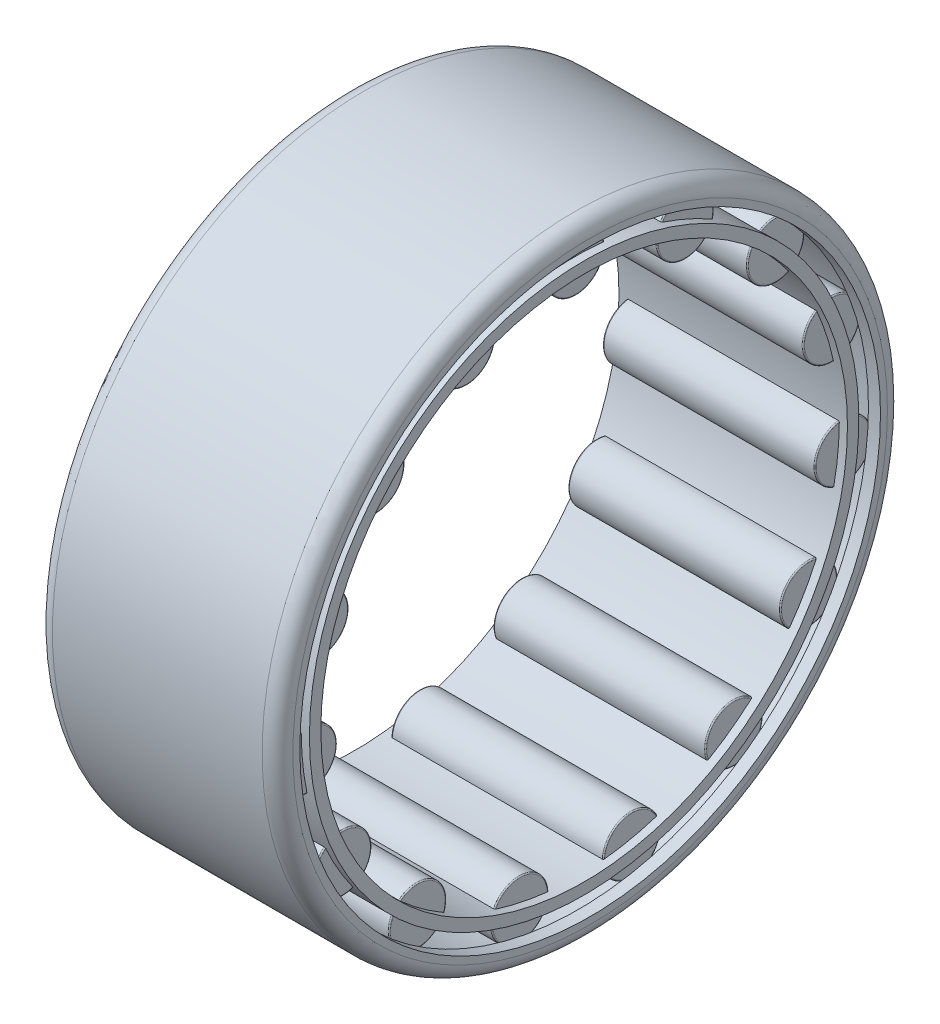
SolidWorks part; units mm, degrees
ref_plane "Plane1" through (0, 0, 0) normal (0, 0, 1) x (1, 0, 0)
ref_plane "Plane2" through (0, 0, 0) normal (0, 1, 0) x (1, 0, 0)
ref_plane "Plane3" through (0, 0, 0) normal (1, 0, 0) x (0, 0, -1)
other "Configuration Table"
sketch "Clipboard" plane through (0, 0, 0) normal (0, 0, 1) x (1, 0, 0)
  line L0 (-10, 0) -> (10, 0) construction
  line L1 (41.1529, 1.4371) -> (62.7517, -4.3503)
  line L2 (41.1529, 1.4371) -> (75.4583, 10.6292)
  line L3 (41.1529, 1.4371) -> (62.7517, -4.3503)
  line L4 (41.1529, 1.4371) -> (-22.3471, -0.7804)
sketch "InnRacSke" plane through (0, 0, 0) normal (0, 0, 1) x (1, 0, 0)
  line L0 (-14.2875, 38.3286) -> (-15.875, 38.3286)
  line L1 (-15.875, 38.3286) -> (-15.875, 39.243)
  line L2 (-13.843, 41.275) -> (13.843, 41.275)
  line L4 (15.875, 39.243) -> (15.875, 38.3286)
  line L5 (15.875, 38.3286) -> (14.2875, 38.3286)
  line L6 (14.2875, 38.3286) -> (14.2875, 39.2811)
  line L7 (14.2875, 39.2811) -> (-14.2875, 39.2811)
  line L8 (-14.2875, 39.2811) -> (-14.2875, 38.3286)
  line L9 (-31.75, 0) -> (31.75, 0) construction
  arc A0 (-15.875, 39.243) -> (-13.843, 41.275) centre (-13.843, 39.243) cw
  arc A2 (13.843, 41.275) -> (15.875, 39.243) centre (13.843, 39.243) cw
revolve "Race" add sketch "InnRacSke" angle 360 about L9
sketch "RolDetSke" plane through (0, 0, 0) normal (0, 0, 1) x (1, 0, 0)
  line L0 (-14.0018, 39.131) -> (-14.0017, 35.5155)
  line L1 (-14.0017, 35.5155) -> (14.0017, 35.5155)
  line L2 (14.0017, 35.5155) -> (14.0018, 39.131)
  line L3 (13.8511, 39.2816) -> (-13.8511, 39.2816)
  line L4 (-28.575, 35.5155) -> (28.575, 35.5155) construction
  arc A0 (14.0018, 39.131) -> (13.8511, 39.2816) centre (13.8511, 39.131) ccw
  arc A1 (-13.8511, 39.2816) -> (-14.0018, 39.131) centre (-13.8511, 39.131) ccw
revolve "RollerDetailed" add sketch "RolDetSke" angle 360 about L4
ref_axis "Axis1" through (-50, 0, 0) along (1, 0, 0)
sketch "CagSpiSke" plane through (0, 0, 0) normal (0, 0, 1) x (1, 0, 0)
  line L0 (15.0812, 34.7623) -> (15.0812, 36.2688)
  line L1 (15.0812, 36.2688) -> (-15.0813, 36.2688)
  line L2 (-15.0813, 36.2688) -> (-15.0813, 34.7623)
  line L3 (-15.0813, 34.7623) -> (15.0812, 34.7623)
  line L4 (-31.75, 0) -> (31.75, 0) construction
revolve "CageSpine" add sketch "CagSpiSke" angle 360 about L4
pattern_circular "RollersDetailed" count 15 every 24 about axis through (-50, 0, 0) along (1, 0, 0) of "RollerDetailed"
sketch "RolSimSke" plane through (0, 0, 0) normal (0, 0, 1) x (1, 0, 0)
  line L0 (-25.4, 0) -> (25.4, 0) construction
  line L2 (-13.8511, 39.2821) -> (13.8511, 39.2821)
  line L3 (-14.0018, 39.1315) -> (-14.0018, 31.9006)
  line L4 (-13.8511, 31.75) -> (13.8511, 31.75)
  line L5 (14.0017, 39.1315) -> (14.0017, 31.9006)
  arc A0 (-14.0018, 31.9006) -> (-13.8511, 31.75) centre (-13.8511, 31.9006) ccw
  arc A1 (-13.8511, 39.2821) -> (-14.0018, 39.1315) centre (-13.8511, 39.1315) ccw
  arc A2 (14.0017, 39.1315) -> (13.8511, 39.2821) centre (13.8511, 39.1315) ccw
  arc A3 (13.8511, 31.75) -> (14.0017, 31.9006) centre (13.8511, 31.9006) ccw
  point P10 (-14.0018, 31.75)
  point P15 (14.0017, 39.2821)
  point P18 (14.0017, 31.75)
revolve "RollersSimplified" [suppressed] add sketch "RolSimSke" angle 360 about L0
equation "\"BallCLRad@Clipboard\" =  ( \"D1@InnRacSke\" + \"Bore@Clipboard\" )  / 4"
equation "\"RollerCLRad@RolDetSke\" =  \"BallCLRad@Clipboard\""
equation "\"halfCyl@InnRacSke\" =  \"Cyl_Len@InnRacSke\" / 2"
equation "\"Roller_diameter@RolDetSke\" =  ( \"D1@InnRacSke\" - \"Bore@Clipboard\" )  / 2 + .001"
equation "\"Roller_radius@RolDetSke\" =  \"Roller_diameter@RolDetSke\" / 50"
equation "\"Roller_length@RolDetSke\" =  \"Cyl_Len@InnRacSke\" * .98"
equation "\"halfLength@RolDetSke\" =  \"Roller_length@RolDetSke\" / 2"
equation "\"Cage_width@CagSpiSke\" =  ( \"Cyl_Len@InnRacSke\" + \"Width@InnRacSke\" )  / 2"
equation "\"halfWidth@CagSpiSke\" =  \"Cage_width@CagSpiSke\" / 2"
equation "\"Roller_length@RolSimSke\" =  \"Cyl_Len@InnRacSke\" * .98"
equation "\"halfWidth@RolSimSke\" =  \"Roller_length@RolSimSke\" / 2"
equation "\"D1@RolSimSke\" =  \"Roller_radius@RolDetSke\""
equation "\"Roller_diameter@RolSimSke\" =  ( \"D1@InnRacSke\" - \"Bore@Clipboard\" )  / 2 + .001"
equation "\"Cage_thickness@CagSpiSke\" =  \"Roller_diameter@RolDetSke\" / 5"
equation "\"D2@CagSpiSke\" =  \"RollerCLRad@RolDetSke\" * 2 - \"Cage_thickness@CagSpiSke\""
equation "\"Max_countClipboard_v1\" =  int( 3.14159265 / atn(( \"Roller_diameter@RolDetSke\" / 2) / sqr( \"RollerCLRad@RolDetSke\"  *  \"RollerCLRad@RolDetSke\" - ( \"Roller_diameter@RolDetSke\" / 2) *  ( \"Roller_diamete"
equation "\"Max_count@Clipboard\" =  ((sgn( \"Max_countClipboard_v1\" - \"Count@Clipboard\" )-1)*( \"Max_countClipboard_v1\" - \"Count@Clipboard\" ))/-2+ \"Count@Clipboard\""
equation "\"CountRollersDetailed_v1\" =  int( \"Show_count@Clipboard\" )"
equation "\"CountRollersDetailed_v2\" =  ((sgn( \"CountRollersDetailed_v1\" - \"Max_count@Clipboard\" )-1)*( \"CountRollersDetailed_v1\" - \"Max_count@Clipboard\" ))/-2+ \"Max_count@Clipboard\""
equation "\"Count@RollersDetailed\" =  ((sgn( \"CountRollersDetailed_v2\" - \"Min_count@Clipboard\" )+1)*( \"CountRollersDetailed_v2\" - \"Min_count@Clipboard\"))/2 +\"Min_count@Clipboard\""
equation "\"Angle@RollersDetailed\" =  360.0 / \"Max_count@Clipboard\""
equation "\"AngleCageSpine_v1\" =  \"Angle@RollersDetailed\" * ( \"Count@RollersDetailed\" -1 + int( \"Count@RollersDetailed\" / \"Max_count@Clipboard\" ) )  + 0.001 -  int( \"Count@RollersDetailed\" / \"Max_count@Clipboard"
equation "\"Angle@CageSpine\" =  \"AngleCageSpine_v1\" * int( \"Min_count@Clipboard\" / 2) + int(1 / \"Min_count@Clipboard\")  * 0.001"
equation "\"Bore@RolSimSke\" =  \"Bore@Clipboard\""
